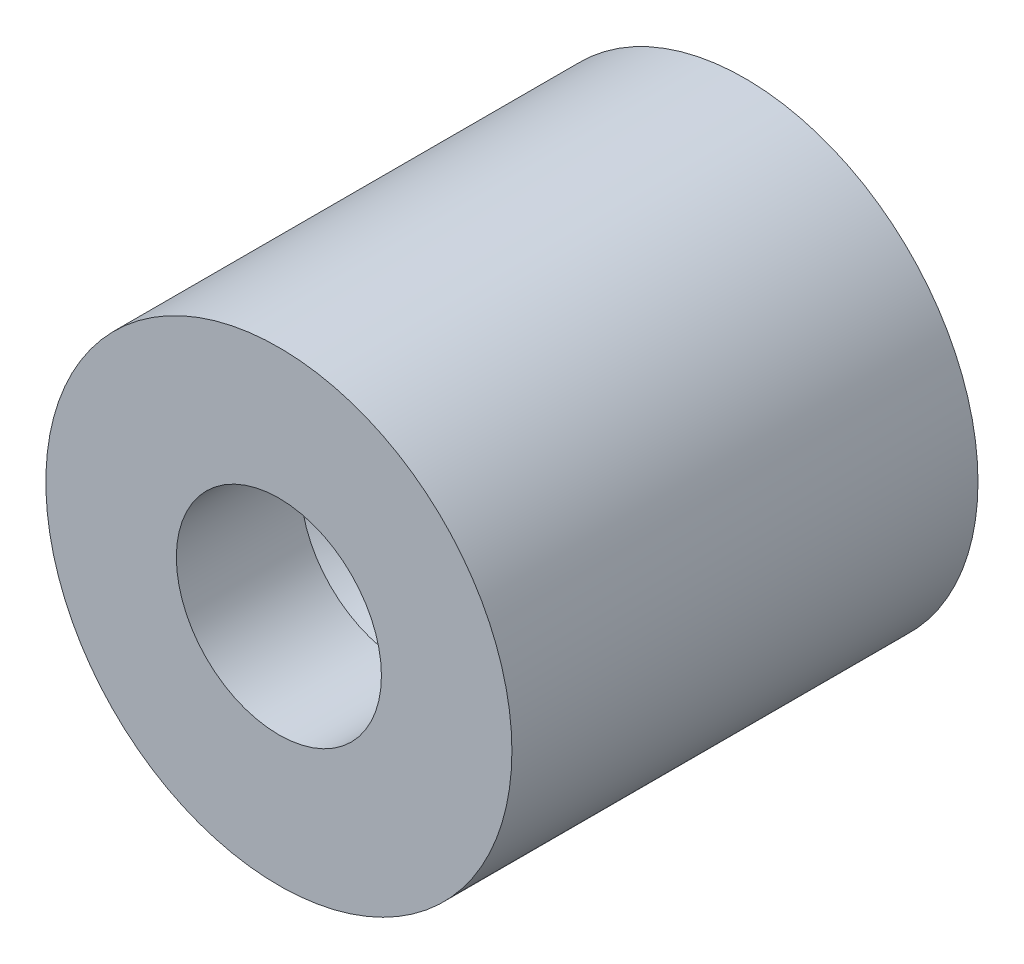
SolidWorks part; units mm, degrees
ref_plane "Plan de face" through (0, 0, 0) normal (0, 0, 1) x (1, 0, 0)
ref_plane "Plan de dessus" through (0, 0, 0) normal (0, 1, 0) x (1, 0, 0)
ref_plane "Plan de droite" through (0, 0, 0) normal (1, 0, 0) x (0, 0, -1)
sketch "Esquisse1" plane through (0, 0, 0) normal (0, 0, 1) x (1, 0, 0)
  circle A0 centre (0, 0) radius 7.5
  dimension "D1" = 15
extrude "Extrusion1" add sketch "Esquisse1" along normal blind 15
hole_wizard "Dégagement M61" positions "Esquisse3" profile "Esquisse2" hole size "M6" standard "ISO"
sketch "Esquisse3" plane through (0, 0, 15) normal (0, 0, 1) x (1, 0, 0)
  point P0 (0, 0)
sketch "Esquisse2" plane through (0, 0, 15) normal (1, 0, 0) x (0, -1, 0)
  line L0 (0, 0) -> (0, 5.9828)
  line L1 (0, 5.9828) -> (3.3, 4)
  line L2 (3.3, 4) -> (3.3, 0)
  line L5 (3.3, 0) -> (0, 0)
  line L10 (0, 5.9828) -> (-3.3, 4) construction
  line L11 (0, -6.35) -> (0, 107.95) construction
  dimension "Diamètre du perçage" = 6.6
  dimension "Profondeur du perçage" = 4
  dimension "Angle de pointe" = 118
hole_wizard "Dégagement M62" positions "Esquisse5" profile "Esquisse4" hole size "M6" standard "ISO"
sketch "Esquisse5" plane through (0, 0, 0) normal (0, 0, -1) x (-1, 0, 0)
  point P0 (0, 0)
sketch "Esquisse4" plane through (0, 0, 0) normal (1, 0, 0) x (0, 1, 0)
  line L0 (0, 0) -> (0, 5.9828)
  line L1 (0, 5.9828) -> (3.3, 4)
  line L2 (3.3, 4) -> (3.3, 0)
  line L5 (3.3, 0) -> (0, 0)
  line L10 (0, 5.9828) -> (-3.3, 4) construction
  line L11 (0, -6.35) -> (0, 107.95) construction
  dimension "Diamètre du perçage" = 6.6
  dimension "Profondeur du perçage" = 4
  dimension "Angle de pointe" = 118
